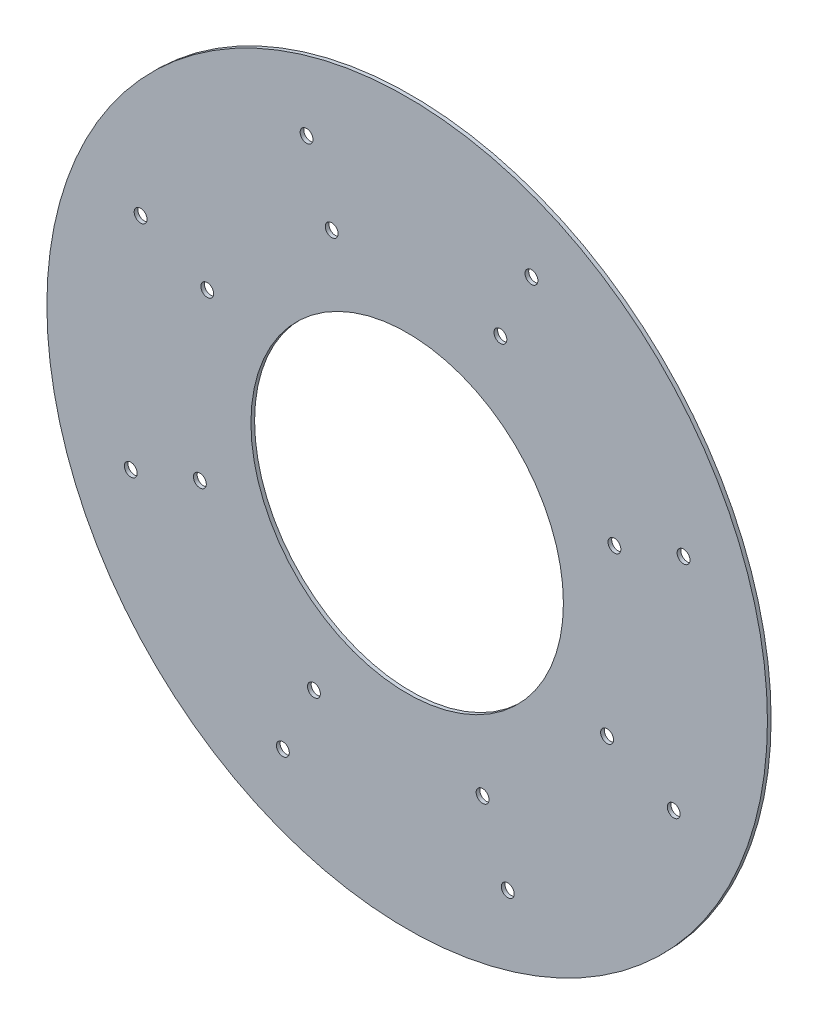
SolidWorks part; units mm, degrees
ref_plane "Plan de face" through (0, 0, 0) normal (0, 0, 1) x (1, 0, 0)
ref_plane "Plan de dessus" through (0, 0, 0) normal (0, 1, 0) x (1, 0, 0)
ref_plane "Plan de droite" through (0, 0, 0) normal (1, 0, 0) x (0, 0, -1)
sketch "Esquisse1" plane through (0, 0, 0) normal (0, 0, 1) x (1, 0, 0)
  circle A0 centre (0, 0) radius 425
  circle A1 centre (0, 0) radius 980
  dimension "D1" = 1960
  dimension "D2" = 850
extrude "Boss.-Extru.1" add sketch "Esquisse1" along normal blind 10
sketch "Esquisse2" plane through (0, 0, 10) normal (0, 0, 1) x (1, 0, 0)
  line L0 (0, 0) -> (-338.0946, -725.0462) construction
  line L1 (-338.0946, -725.0462) -> (0, 0) construction
  line L2 (0, 0) -> (0, -918.6266) construction
  circle A0 centre (-253.571, -543.7847) radius 17.5
  circle A1 centre (-338.0946, -725.0462) radius 17.5
  dimension "D4" = 35
  dimension "D1" = 25
  dimension "D2" = 800
  dimension "D3" = 600
extrude "Enlèv. mat.-Extru.1" cut sketch "Esquisse2" against normal through all
pattern_circular "Répétition circulaire1" count 8 over 360 about axis through (0, 0, 0) along (0, 0, 1) of "Enlèv. mat.-Extru.1"
